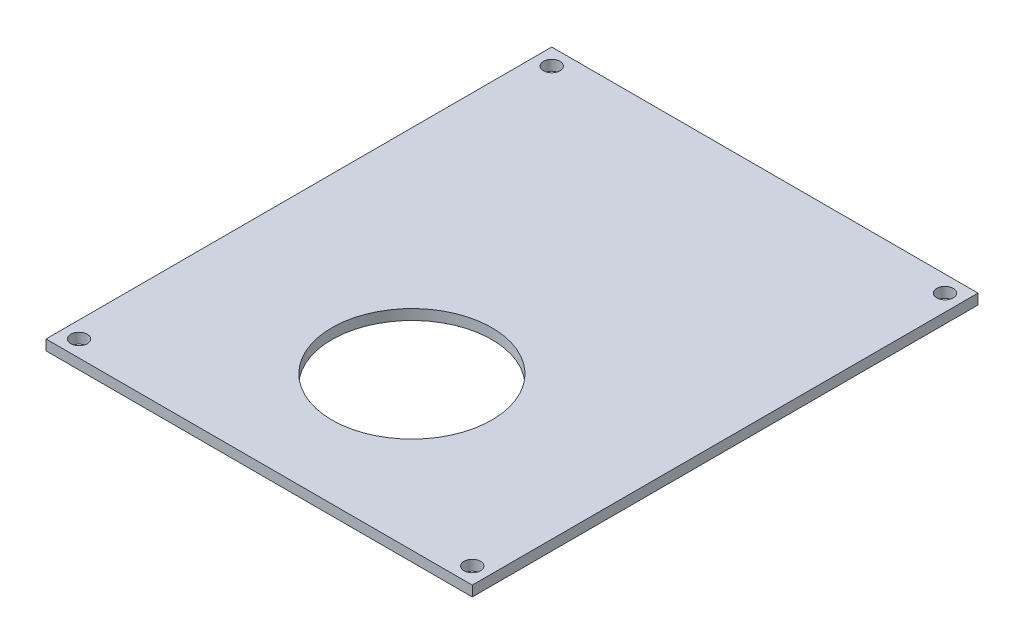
SolidWorks part; units mm, degrees
ref_plane "Front Plane" through (0, 0, 0) normal (0, 0, 1) x (1, 0, 0)
ref_plane "Top Plane" through (0, 0, 0) normal (0, 1, 0) x (1, 0, 0)
ref_plane "Right Plane" through (0, 0, 0) normal (1, 0, 0) x (0, 0, -1)
sketch "Sketch1" plane through (0, 0, 0) normal (0, 1, 0) x (1, 0, 0)
  line L1 (41.3, 49) -> (-41.3, 49)
  line L2 (41.3, 49) -> (41.3, -49)
  line L3 (41.3, -49) -> (-41.3, -49)
  line L4 (-41.3, 49) -> (-41.3, -49)
  line L5 (41.3, 49) -> (-41.3, -49) construction
  line L6 (41.3, -49) -> (-41.3, 49) construction
  point P0 (0, 0)
  dimension "D1" = 82.6
  dimension "D2" = 98
extrude "Boss-Extrude1" add sketch "Sketch1" along normal blind 2
hole_wizard "Ø3.2 (3.2) Diameter Hole1" positions "Sketch3" profile "Sketch2" hole size "Ø3.2" standard "ISO"
sketch "Sketch3" plane through (0, 2, 0) normal (0, 1, 0) x (1, 0, 0)
  line L0 (-41.3, 49) -> (-41.3, -49) construction
  line L1 (41.3, 49) -> (-41.3, 49) construction
  line L2 (41.3, -49) -> (41.3, 49) construction
  line L3 (-41.3, -49) -> (41.3, -49) construction
  point P0 (-38.1, 45.8)
  point P2 (38.1, 45.8)
  point P4 (38.1, -45.8)
  point P6 (-38.1, -45.8)
  dimension "D1" = 3.2
  dimension "D2" = 3.2
  dimension "D3" = 3.2
  dimension "D4" = 3.2
  dimension "D5" = 3.2
  dimension "D6" = 3.2
  dimension "D7" = 3.2
  dimension "D8" = 3.2
sketch "Sketch2" plane through (-38.1, 2, -45.8) normal (1, 0, 0) x (0, 0, 1)
  line L0 (0, 0) -> (0, 2)
  line L1 (0, 2) -> (1.6, 2)
  line L2 (1.6, 2) -> (1.6, 0)
  line L5 (1.6, 0) -> (0, 0)
  line L11 (0, -6.35) -> (0, 107.95) construction
  dimension "Thru Hole Dia." = 3.2
  dimension "Thru Hole Depth" = 2
sketch "Sketch4" plane through (0, 2, 0) normal (0, 1, 0) x (1, 0, 0)
  line L0 (-41.3, -49) -> (41.3, -49) construction
  circle A1 centre (0, -19.4) radius 15.5
  dimension "D2" = 31
  dimension "D3" = 29.6
extrude "Cut-Extrude1" cut sketch "Sketch4" against normal blind 2
